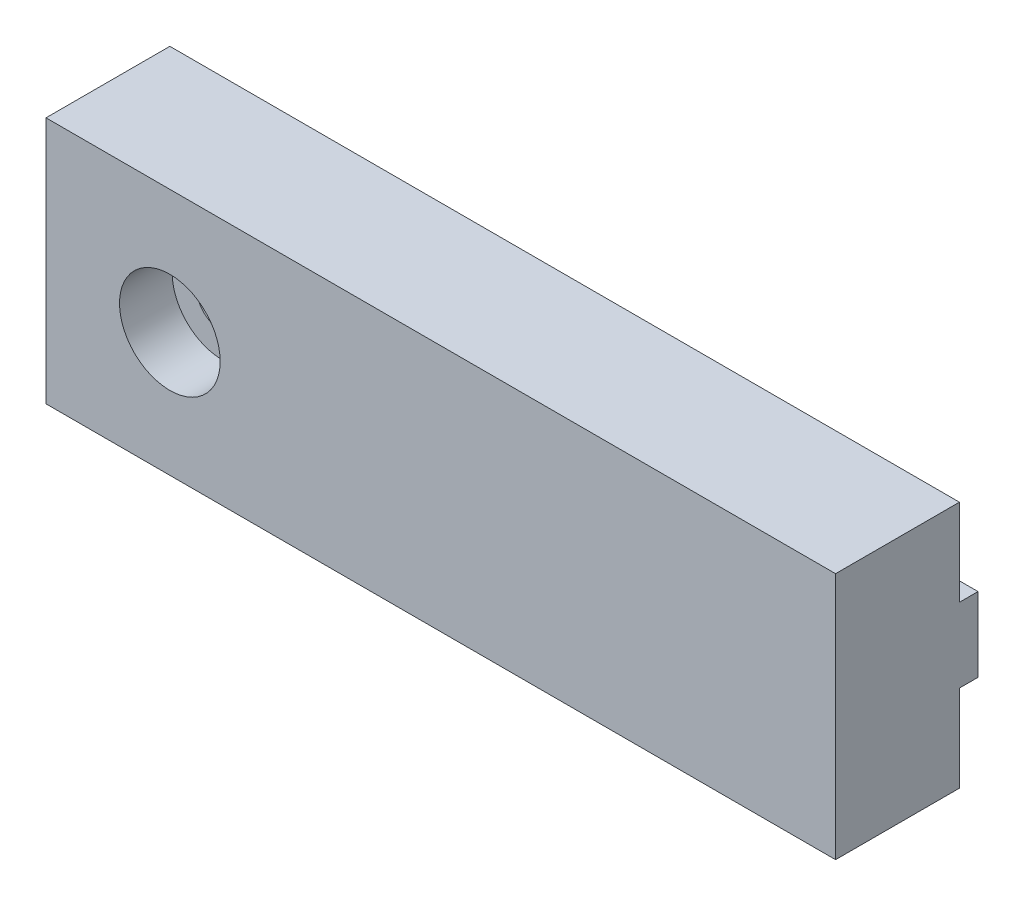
SolidWorks part; units mm, degrees
ref_plane "Aufriss" through (0, 0, 0) normal (0, 0, 1) x (1, 0, 0)
ref_plane "Grundriss" through (0, 0, 0) normal (0, 1, 0) x (1, 0, 0)
ref_plane "Seitenriss" through (0, 0, 0) normal (1, 0, 0) x (0, 0, -1)
sketch "Skizze1" plane through (0, 0, 0) normal (0, 0, 1) x (1, 0, 0)
  line L1 (-25.5, -8) -> (25.5, -8)
  line L2 (-25.5, -8) -> (-25.5, 8)
  line L3 (-25.5, 8) -> (25.5, 8)
  line L4 (25.5, -8) -> (25.5, 8)
  line L5 (-25.5, -8) -> (25.5, 8) construction
  line L6 (-25.5, 8) -> (25.5, -8) construction
  point P0 (0, 0)
  dimension "D1" = 16
  dimension "D2" = 51
extrude "Aufsatz-Linear austragen1" add sketch "Skizze1" along normal blind 8
sketch "Skizze2" plane through (0, 0, 0) normal (0, 0, -1) x (-1, 0, 0)
  line L0 (-25.5, -8) -> (-25.5, 8) construction
  line L1 (-25.5, 2.4) -> (25.5, 2.4)
  line L2 (-25.5, 2.4) -> (-25.5, -2.4)
  line L3 (-25.5, -2.4) -> (25.5, -2.4)
  line L4 (25.5, 2.4) -> (25.5, -2.4)
  line L5 (25.5, 8) -> (25.5, -8) construction
  line L6 (-25.5, 0) -> (0, 0) construction
  dimension "D1" = 4.8
extrude "Aufsatz-Linear austragen2" add sketch "Skizze2" along normal blind 1.2
hole_wizard "Stirnsenkung für M3 Zylinderschraube mit Innensechskant1" positions "Skizze3" profile "Skizze4" counterbore size "M3" standard "DIN"
sketch "Skizze3" plane through (0, 0, 8) normal (0, 0, 1) x (1, 0, 0)
  line L0 (-25.5, 8) -> (-25.5, -8) construction
  point P0 (-17.5, 0)
  dimension "D1" = 8
sketch "Skizze4" plane through (-17.5, 0, 8) normal (1, 0, 0) x (0, -1, 0)
  line L0 (0, 0) -> (0, 9.2)
  line L1 (0, 9.2) -> (1.7, 9.2)
  line L3 (1.7, 9.2) -> (1.7, 3.4)
  line L4 (1.7, 3.4) -> (3.25, 3.4)
  line L5 (3.25, 3.4) -> (3.25, 0)
  line L7 (3.25, 0) -> (0, 0)
  line L11 (0, -6.35) -> (0, 107.95) construction
  dimension "Bohrerdurchmesser" = 3.4
  dimension "Bohrungstiefe" = 9.2
  dimension "Senkdurchmesser2" = 6.5
  dimension "Senktiefe2" = 3.4
